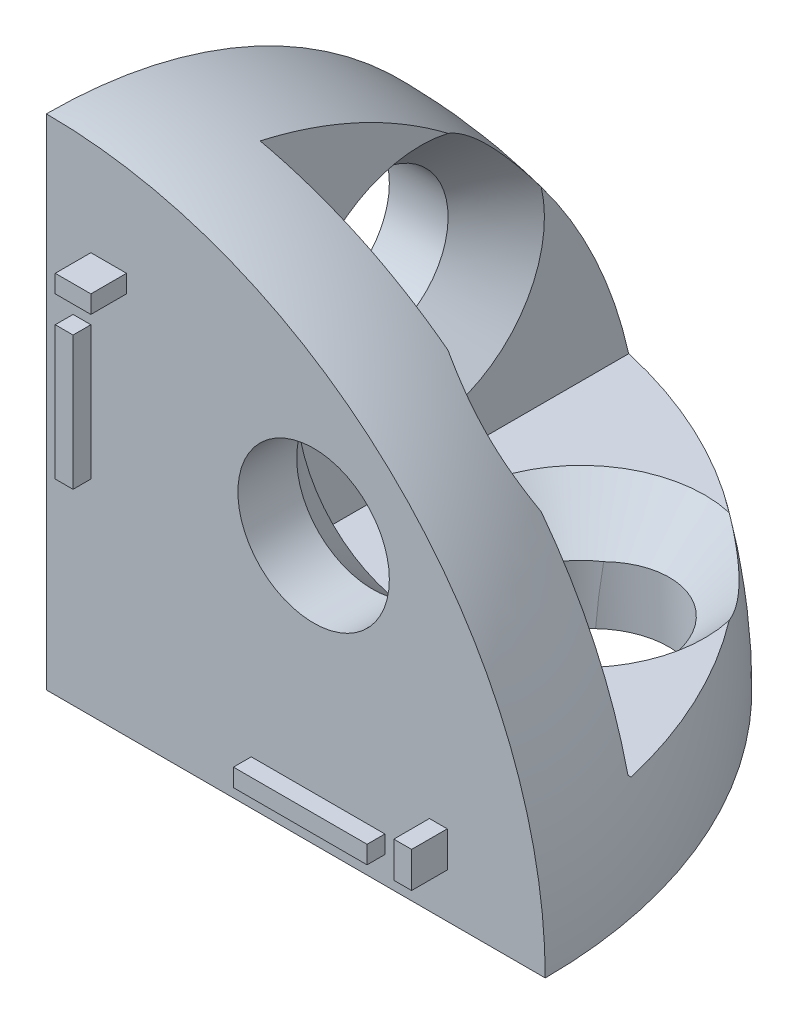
SolidWorks part; units mm, degrees
ref_plane "前视基准面" through (0, 0, 0) normal (0, 0, 1) x (1, 0, 0)
ref_plane "上视基准面" through (0, 0, 0) normal (0, 1, 0) x (1, 0, 0)
ref_plane "右视基准面" through (0, 0, 0) normal (1, 0, 0) x (0, 0, -1)
sketch "草图1" plane through (0, 0, 0) normal (0, 0, 1) x (1, 0, 0)
  line L0 (0, 28) -> (0, 0)
  line L1 (0, 0) -> (28, 0)
  arc A0 (28, 0) -> (0, 28) centre (0, 0) ccw
  dimension "D1" = 28
revolve "旋转2" add sketch "草图1" angle 90 about L0
ref_plane "基准面1" through (0, 0, -6) normal (0, 0, 1) x (1, 0, 0)
sketch "草图2" plane through (0, 0, -6) normal (0, 0, 1) x (1, 0, 0)
  line L0 (6, 27.3577) -> (6, 6)
  line L1 (6, 6) -> (26.6438, 6)
  line L2 (26.6438, 6) -> (26.6438, 29.3498)
  line L3 (26.6438, 29.3498) -> (6, 27.3577)
  line L4 (0, 28) -> (0, 0) construction
  line L5 (0, 0) -> (28, 0) construction
  dimension "D1" = 6
  dimension "D2" = 6
extrude "切除-拉伸1" cut sketch "草图2" against normal through all
sketch "草图3" plane through (0, 0, 0) normal (0, 0, 1) x (1, 0, 0)
  line L0 (0, 28) -> (0, 0) construction
  line L1 (0, 0) -> (28, 0) construction
  circle A0 centre (15, 15) radius 4.25
  dimension "D3" = 8.5
  dimension "D1" = 15
  dimension "D2" = 15
extrude "切除-拉伸2" cut sketch "草图3" against normal blind 10
ref_plane "基准面2" through (0, 0, 0) normal (-0.7071, 0, -0.7071) x (-0.7071, 0, 0.7071)
mirror "镜向1" about plane through (0, 0, 0) normal (-0.7071, 0, -0.7071) of "切除-拉伸2"
ref_plane "基准面3" through (0.008, -0.3287, -0.34) normal (-0.0169, 0.695, 0.7189) x (0.9999, 0.0117, 0.0121)
mirror "镜向2" about plane through (0.008, -0.3287, -0.34) normal (-0.0169, 0.695, 0.7189) of "切除-拉伸2"
sketch "草图4" plane through (0, 0, 0) normal (0, 0, 1) x (1, 0, 0)
  line L0 (0, 0) -> (28, 0) construction
  line L1 (1.5, 19) -> (2.5, 19)
  line L2 (1.5, 19) -> (1.5, 11.5)
  line L3 (1.5, 11.5) -> (2.5, 11.5)
  line L4 (2.5, 19) -> (2.5, 11.5)
  line L5 (11.5, 2.5) -> (19, 2.5)
  line L6 (11.5, 2.5) -> (11.5, 1.5)
  line L7 (11.5, 1.5) -> (19, 1.5)
  line L8 (19, 2.5) -> (19, 1.5)
  line L9 (0, 28) -> (0, 0) construction
  dimension "D1" = 19
  dimension "D2" = 19
  dimension "D3" = 2.5
  dimension "D4" = 2.5
  dimension "D5" = 1
  dimension "D6" = 1
  dimension "D7" = 7.5
  dimension "D8" = 7.5
extrude "凸台-拉伸1" add sketch "草图4" along normal blind 1
sketch "草图5" plane through (0, 0, 0) normal (0, 0, 1) x (1, 0, 0)
  line L0 (0, 0) -> (28, 0) construction
  line L1 (2.5, 22.5) -> (4.5, 22.5)
  line L2 (2.5, 22.5) -> (2.5, 21.5)
  line L3 (2.5, 21.5) -> (4.5, 21.5)
  line L4 (4.5, 22.5) -> (4.5, 21.5)
  line L5 (21.5, 4.5) -> (22.5, 4.5)
  line L6 (21.5, 4.5) -> (21.5, 2.5)
  line L7 (21.5, 2.5) -> (22.5, 2.5)
  line L8 (22.5, 4.5) -> (22.5, 2.5)
  line L9 (0, 28) -> (0, 0) construction
  dimension "D1" = 2
  dimension "D2" = 1
  dimension "D3" = 2
  dimension "D4" = 1
  dimension "D5" = 22.5
  dimension "D6" = 22.5
  dimension "D7" = 4.5
  dimension "D8" = 4.5
extrude "凸台-拉伸2" add sketch "草图5" along normal blind 2
mirror "镜向3" about plane through (0, 0, 0) normal (-0.7071, 0, -0.7071) of "凸台-拉伸2", "凸台-拉伸1"
mirror "镜向4" about plane through (0.008, -0.3287, -0.34) normal (-0.0169, 0.695, 0.7189) of "凸台-拉伸1", "凸台-拉伸2"
sketch "草图7" plane through (0.0165, -0.6795, -0.0228) normal (-0.0243, 0.9991, 0.0335) x (0.9997, 0.0243, 0.0008)
  circle A0 centre (15.3476, 15.3012) radius 4.25
extrude "切除-拉伸3" cut sketch "草图7" against normal blind 10
sketch "草图8" plane through (0, 0, -6) normal (0, 0, -1) x (-1, 0, 0)
  circle A0 centre (-15, 15) radius 4.25
sketch "草图11" plane through (0, 0, -6) normal (0, 0, -1) x (-1, 0, 0)
  circle A0 centre (-15, 15) radius 4.25
ref_plane "基准面4" through (0, 15, 0) normal (0, -1, 0) x (-1, 0, 0)
sketch "草图12" plane through (0, 15, 0) normal (0, -1, 0) x (-1, 0, 0)
  line L0 (-19.25, 6) -> (-19.25, 3.2973)
  line L2 (-21.9527, 6) -> (-19.25, 3.2973)
  line L5 (-19.25, 6) -> (-21.9527, 6)
sweep "切除-扫描4" cut profiles "草图12" path "草图8"
ref_plane "基准面5" through (0, 0, 0) normal (0, 0.7071, 0.7071) x (1, 0, 0)
mirror "镜向5" about plane through (0, 0, 0) normal (0, 0.7071, 0.7071) of "切除-拉伸2", "切除-扫描4"
ref_plane "基准面6" through (0, 0, 0) normal (0.7071, -0.7071, 0) x (0, 0, -1)
mirror "镜向6" about plane through (0, 0, 0) normal (0.7071, -0.7071, 0) of "镜向5"
